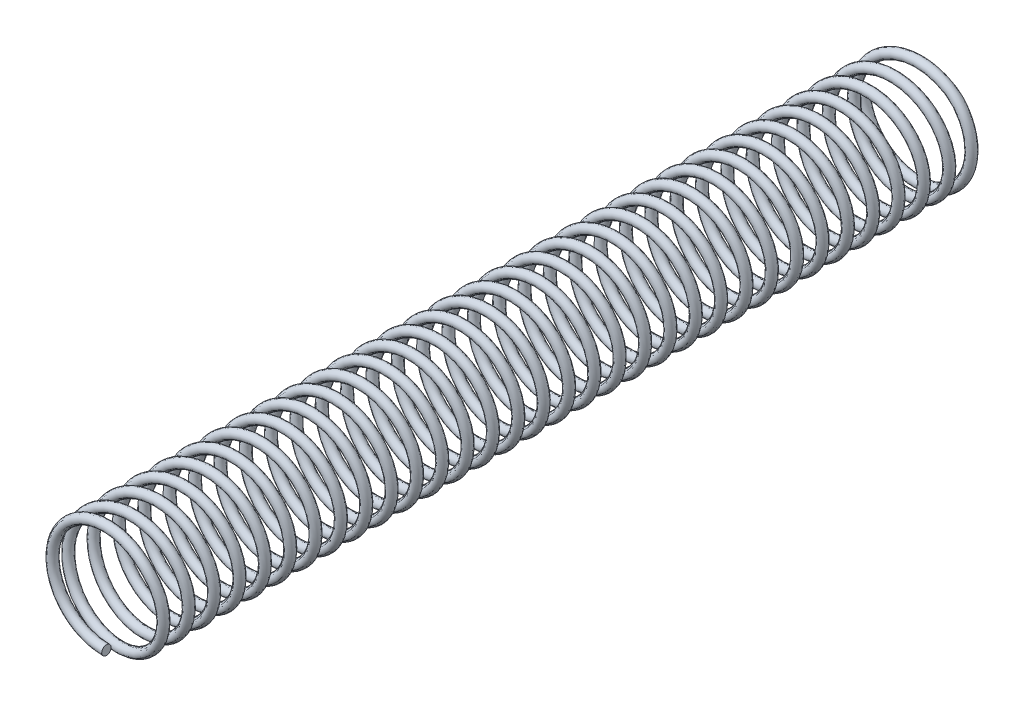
SolidWorks part; units mm, degrees
ref_plane "Front Plane" through (0, 0, 0) normal (0, 0, 1) x (1, 0, 0)
ref_plane "Top Plane" through (0, 0, 0) normal (0, 1, 0) x (1, 0, 0)
ref_plane "Right Plane" through (0, 0, 0) normal (1, 0, 0) x (0, 0, -1)
sketch "Sketch1" plane through (0, 0, 0) normal (1, 0, 0) x (0, 0, -1)
  line L0 (-22.225, 0) -> (22.225, 0) construction
  line L1 (-22.225, 3.175) -> (-22.225, -3.175) construction
  line L3 (-8.509, 0) -> (8.509, 0) construction
  line L4 (-22.225, -3.175) -> (-21.717, -3.175) construction
  line L5 (-22.225, -3.175) -> (-22.225, -2.667) construction
  line L7 (-21.717, -3.175) -> (-21.717, -2.667) construction
  line L8 (-22.225, 3.175) -> (22.225, 3.175) construction
  line L9 (-22.225, -2.667) -> (-21.717, -2.667) construction
  line L10 (-22.225, -2.667) -> (-22.225, 2.667) construction
  circle A0 centre (-21.971, -2.921) radius 0.254 construction
  point P5 (-14.2875, 3.175)
  point P13 (14.2875, 3.175)
sketch "Sketch2" plane through (0, 0, 0) normal (1, 0, 0) x (0, 0, -1)
  line L0 (-22.225, -3.175) -> (-21.717, -3.175) construction
  line L5 (-22.225, 3.175) -> (-22.225, -3.175) construction
  line L6 (-21.717, -3.175) -> (-21.717, -2.667) construction
  circle A0 centre (-21.971, -2.921) radius 0.254
ref_plane "Plane5" through (0, 0, 22.225) normal (0, 0, 1) x (1, 0, 0)
ref_plane "Plane1" through (0, 0, 21.971) normal (0, 0, 1) x (1, 0, 0)
sketch "Sketch3" plane through (0, 0, 21.971) normal (0, 0, 1) x (1, 0, 0)
  line L0 (0, 0) -> (0, -2.921) construction
  line L1 (0, 0) -> (2.0948, 2.0357) construction
  line L2 (0, 0) -> (2.921, 0) construction
  circle A0 centre (0, 0) radius 2.921 construction
  arc A1 (0, -2.921) -> (2.0948, 2.0357) centre (0, 0) cw
sketch "Sketch5" plane through (0, 0, 21.971) normal (0, 0, 1) x (1, 0, 0)
  circle A0 centre (0, 0) radius 2.921 construction
  circle A1 centre (0, 0) radius 2.921
curve "Helix/Spiral2"
ref_plane "Plane3" through (0, 0, -22.225) normal (0, 0, 1) x (1, 0, 0)
ref_plane "Plane4" through (0, 0, -21.971) normal (0, 0, 1) x (1, 0, 0)
sketch "Sketch7" plane through (0, 0, -21.971) normal (0, 0, 1) x (1, 0, 0)
  line L0 (2.0948, 2.0357) -> (0, 0) construction
  line L1 (0, 0) -> (-2.9198, 0.0837) construction
  line L2 (0, -2.921) -> (2.0948, 2.0357) construction
  line L3 (-2.9198, 0.0837) -> (2.0948, 2.0357) construction
  line L4 (-2.9198, 0.0837) -> (0, -2.921) construction
  circle A0 centre (0, 0) radius 2.921 construction
  circle A1 centre (0, 0) radius 2.921 construction
  arc A2 (2.0948, 2.0357) -> (-2.9198, 0.0837) centre (0, 0) cw
  arc A6 (2.0948, 2.0357) -> (0, -2.921) centre (0, 0) ccw construction
  arc A7 (2.0948, 2.0357) -> (0, -2.921) centre (0, 0) ccw construction
sketch3d "3DSketch4"
  line L0 (0, 0, 21.971) -> (0, -2.921, 21.971) construction
  line L1 (0, 0, -21.971) -> (-2.9198, 0.0837, -21.971) construction
  arc A2 (2.0948, 2.0357, -21.971) -> (-2.9198, 0.0837, -21.971) centre (0, 0, -21.971) ccw construction
  arc A3 (0, -2.921, 21.971) -> (2.0948, 2.0357, 21.971) centre (0, 0, 21.971) ccw construction
  circle A4 centre (0, 0, 21.971) radius 2.921 construction
  circle A5 centre (0, 0, -21.971) radius 2.921 construction
  spline S1 degree 3 number of poles 515 (2.0948, 2.0357, 21.971) -> (2.0948, 2.0357, -21.971) construction
  spline S2 degree 3 number of poles 537 (0, -2.921, 21.971) -> (-2.9198, 0.0837, -21.971)
  point P3 (0, 0, -24.892)
  point P9 (0, 0, 19.05)
  point P17 (0, 0, 24.892)
  point P22 (0, 0, -19.05)
sweep "Sweep5" add profiles "Sketch2" path "3DSketch4"
sketch "Reference Sketch1" plane through (0, 0, 0) normal (0, 0, 1) x (1, 0, 0)
  circle A0 centre (0, 0) radius 2.667 construction
  circle A1 centre (0, 0) radius 3.175 construction
equation "\"N\"= \"Compressed Length@Sketch1\" / \"Wire Diameter@Sketch1\""
equation "\"N0\"= int ( \"N\" ) - 1"
equation "\"D7@Helix/Spiral2\"= \"D2@Sketch3\""
equation "\"D1@Sketch3\" = 359 - \"Wire Diameter@Sketch1\" * 360 * \"N0\" / ( \"Length@Sketch1\" - \"Wire Diameter@Sketch1\" )"
equation "\"D5@Helix/Spiral2\"=\"N0\""
equation "\"D3@Helix/Spiral2\" = \"Length@Sketch1\" - \"Wire Diameter@Sketch1\""
equation "\"D1@Plane4\"=\"Wire Diameter@Sketch1\"*0.5"
equation "\"D1@Plane1\"=\"Wire Diameter@Sketch1\"*0.5"
equation "\"D1@Sketch1\"=\"OD@Sketch1\"*1.25"
equation "\"D2@Sketch1\"=\"D1@Sketch1\""
